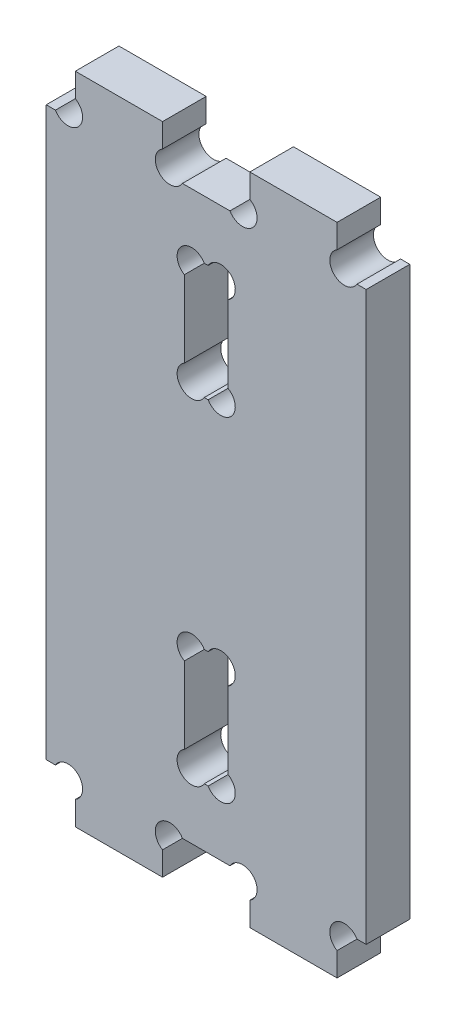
SolidWorks part; units mm, degrees
ref_plane "前视基准面" through (0, 0, 0) normal (0, 0, 1) x (1, 0, 0)
ref_plane "上视基准面" through (0, 0, 0) normal (0, 1, 0) x (1, 0, 0)
ref_plane "右视基准面" through (0, 0, 0) normal (1, 0, 0) x (0, 0, -1)
sketch "草图1" plane through (0, 0, 0) normal (0, 0, 1) x (1, 0, 0)
  line L1 (-11, -19.5) -> (11, -19.5)
  line L2 (-11, -19.5) -> (-11, 19.5)
  line L3 (-11, 19.5) -> (11, 19.5)
  line L4 (11, -19.5) -> (11, 19.5)
  line L5 (-11, -19.5) -> (11, 19.5) construction
  line L6 (-11, 19.5) -> (11, -19.5) construction
  point P0 (0, 0)
  dimension "D1" = 22
  dimension "D2" = 39
extrude "凸台-拉伸1" add sketch "草图1" along normal blind 3
sketch "草图2" plane through (0, 0, 3) normal (0, 0, 1) x (1, 0, 0)
  line L0 (0, 19.5) -> (0, -19.5) construction
  line L1 (11, 19.5) -> (-11, 19.5) construction
  line L2 (-11, -19.5) -> (11, -19.5) construction
  line L3 (-11, 0) -> (11, 0) construction
  line L4 (-11, 19.5) -> (-11, -19.5) construction
  line L5 (11, -19.5) -> (11, 19.5) construction
  line L6 (1.5, -7.5) -> (1.5, -15.5)
  line L7 (-1.5, 7.5) -> (1.5, 7.5)
  line L8 (-1.5, 7.5) -> (-1.5, 15.5)
  line L9 (-1.5, 15.5) -> (1.5, 15.5)
  line L10 (1.5, 7.5) -> (1.5, 15.5)
  line L11 (-1.5, 7.5) -> (1.5, 15.5) construction
  line L12 (-1.5, 15.5) -> (1.5, 7.5) construction
  line L13 (-1.5, -7.5) -> (1.5, -7.5)
  line L14 (-1.5, -15.5) -> (1.5, -15.5)
  line L15 (-1.5, -7.5) -> (-1.5, -15.5)
  point P12 (0, 11.5)
  dimension "D1" = 8
  dimension "D2" = 3
  dimension "D3" = 15
extrude "切除-拉伸1" cut sketch "草图2" against normal blind 4
sketch "草图3" plane through (0, 0, 0) normal (0, 0, 1) x (1, 0, 0)
  line L0 (0, 19.5) -> (0, -19.5) construction
  line L1 (11, 19.5) -> (-11, 19.5) construction
  line L2 (-11, -19.5) -> (11, -19.5) construction
  line L3 (3, 19.5) -> (3, 22.5)
  line L4 (-9, 19.5) -> (-3, 19.5)
  line L5 (-9, 19.5) -> (-9, 22.5)
  line L6 (-9, 22.5) -> (-3, 22.5)
  line L7 (-3, 19.5) -> (-3, 22.5)
  line L8 (9, 22.5) -> (3, 22.5)
  line L9 (9, 19.5) -> (9, 22.5)
  line L10 (9, 19.5) -> (3, 19.5)
  line L11 (-11, 0) -> (11, 0) construction
  line L12 (-11, 19.5) -> (-11, -19.5) construction
  line L13 (11, -19.5) -> (11, 19.5) construction
  line L14 (9, -19.5) -> (3, -19.5)
  line L15 (9, -19.5) -> (9, -22.5)
  line L16 (9, -22.5) -> (3, -22.5)
  line L17 (-3, -19.5) -> (-3, -22.5)
  line L18 (-9, -22.5) -> (-3, -22.5)
  line L19 (-9, -19.5) -> (-9, -22.5)
  line L20 (-9, -19.5) -> (-3, -19.5)
  line L21 (3, -19.5) -> (3, -22.5)
  dimension "D1" = 3
  dimension "D2" = 6
  dimension "D3" = 6
extrude "凸台-拉伸2" add sketch "草图3" along normal blind 3
hole_wizard "Ø2.0 (2) 直径孔1" positions "草图4" profile "草图5" hole size "Ø2.0" standard "GB"
sketch "草图4" plane through (0, 0, 3) normal (0, 0, 1) x (1, 0, 0)
  line L0 (1.5, 15.5) -> (-1.5, 15.5) construction
  line L1 (-1.5, 15.5) -> (-1.5, 7.5) construction
  line L2 (-1.5, 11.5) -> (1.5, 11.5) construction
  line L3 (1.5, 7.5) -> (1.5, 15.5) construction
  line L5 (0, 15.5) -> (0, 7.5) construction
  line L6 (-1.5, 7.5) -> (1.5, 7.5) construction
  line L8 (-11, 0) -> (11, 0) construction
  line L9 (-11, 19.5) -> (-11, -19.5) construction
  line L10 (11, -19.5) -> (11, 19.5) construction
  line L11 (-9, 19.5) -> (-11, 19.5) construction
  line L12 (-9, 22.5) -> (-9, 19.5) construction
  line L13 (-6, 22.5) -> (-6, 26.8664) construction
  line L14 (-3, 22.5) -> (-9, 22.5) construction
  point P2 (-1, 15)
  point P21 (1, 15)
  point P22 (1, 8)
  point P23 (-1, 8)
  point P31 (-1, -8)
  point P32 (1, -8)
  point P33 (1, -15)
  point P34 (-1, -15)
  point P35 (-9.5, 20)
  point P48 (-2.5, 20)
  point P51 (2.5, 20)
  point P52 (9.5, 20)
  point P53 (9.5, -20)
  point P54 (2.5, -20)
  point P55 (-2.5, -20)
  point P56 (-9.5, -20)
  dimension "D1" = 0.5
  dimension "D2" = 0.5
  dimension "D3" = 0.5
  dimension "D4" = 0.5
sketch "草图5" plane through (-1, 15, 3) normal (1, 0, 0) x (0, -1, 0)
  line L0 (0, 0) -> (0, 3)
  line L1 (0, 3) -> (1, 3)
  line L2 (1, 3) -> (1, 0)
  line L5 (1, 0) -> (0, 0)
  line L11 (0, -6.35) -> (0, 107.95) construction
  dimension "通孔孔直径" = 2
  dimension "通孔孔深度" = 3
